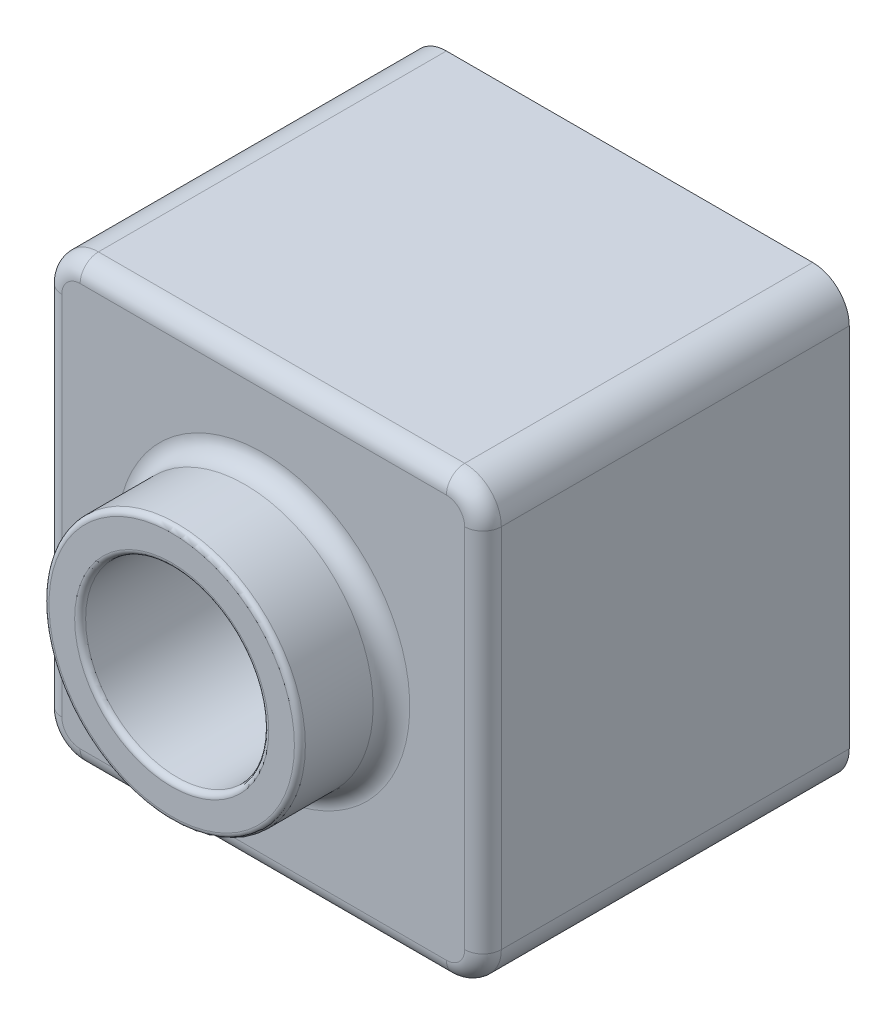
SolidWorks part; units mm, degrees
ref_plane "Front Plane" through (0, 0, 0) normal (0, 0, 1) x (1, 0, 0)
ref_plane "Top Plane" through (0, 0, 0) normal (0, 1, 0) x (1, 0, 0)
ref_plane "Right Plane" through (0, 0, 0) normal (1, 0, 0) x (0, 0, -1)
sketch "Sketch2" plane through (0, 0, 0) normal (0, 0, 1) x (1, 0, 0)
  line L1 (0, 0) -> (120, 0)
  line L2 (0, 0) -> (0, 120)
  line L3 (0, 120) -> (120, 120)
  line L4 (120, 0) -> (120, 120)
  dimension "D1" = 120
  dimension "D2" = 120
extrude "Boss-Extrude1" add sketch "Sketch2" along normal blind 100
sketch "Sketch4" plane through (0, 0, 100) normal (0, 0, 1) x (1, 0, 0)
  line L0 (120, 120) -> (0, 120) construction
  line L1 (0, 120) -> (0, 0) construction
  circle A0 centre (60, 60) radius 35
  dimension "D1" = 60
  dimension "D3" = 70
  dimension "D2" = 60
extrude "Boss-Extrude2" add sketch "Sketch4" along normal blind 25
sketch "Sketch6" plane through (0, 0, 125) normal (0, 0, 1) x (1, 0, 0)
  circle A0 centre (60, 60) radius 25
  dimension "D1" = 50
extrude "Cut-Extrude1" cut sketch "Sketch6" against normal through all
fillet "Fillet1" radius 10 4 edges at (0, 0, 50) (120, 0, 50) (120, 120, 50) (0, 120, 50)
fillet "Fillet2" radius 1.5 2 edges at (95, 60, 125) (85, 60, 125)
fillet "Fillet3" radius 5 9 edges at (25, 60, 100) (2.9289, 117.0711, 100) (60, 120, 100) (117.0711, 117.0711, 100) (120, 60, 100) (117.0711, 2.9289, 100) (60, 0, 100) (2.9289, 2.9289, 100) (0, 60, 100)
shell "Shell1" thickness 2
